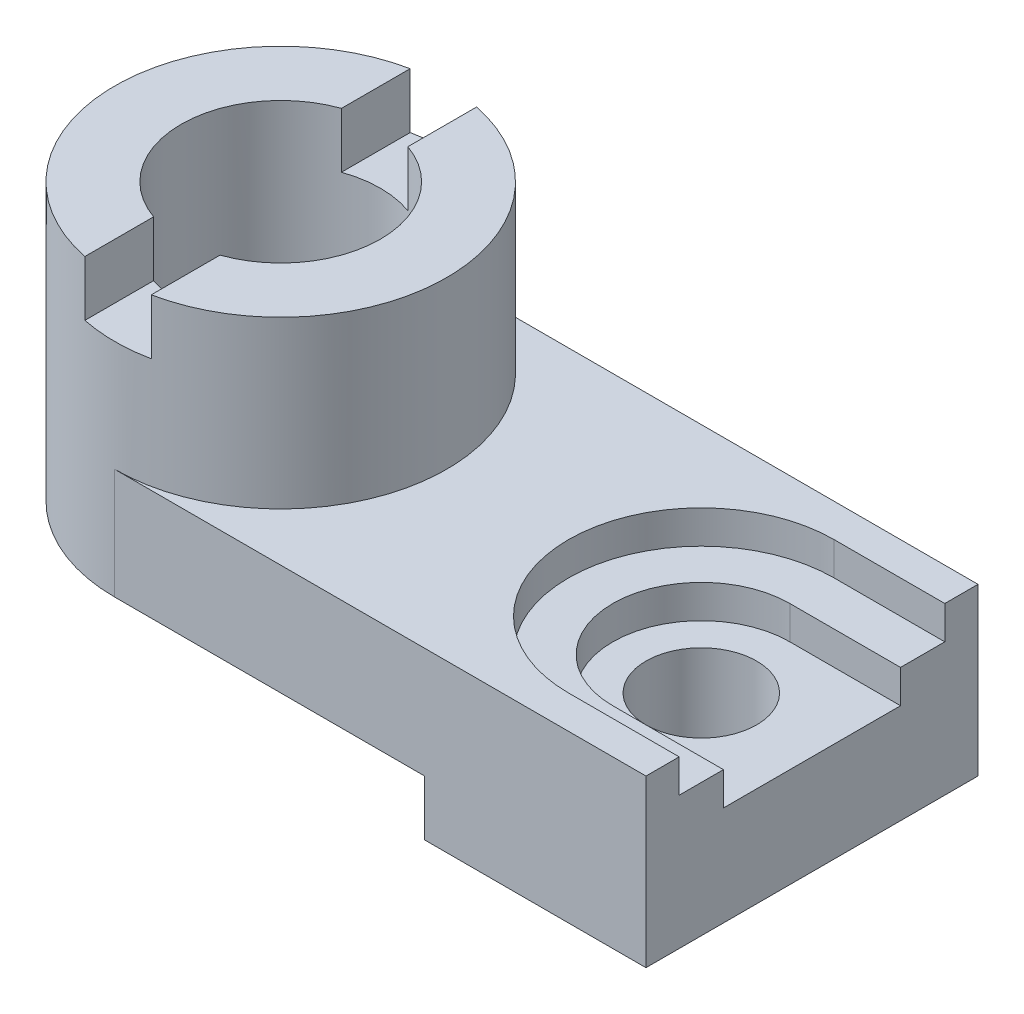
SolidWorks part; units mm, degrees
ref_plane "前视" through (0, 0, 0) normal (0, 0, 1) x (1, 0, 0)
ref_plane "上视" through (0, 0, 0) normal (0, 1, 0) x (1, 0, 0)
ref_plane "右视" through (0, 0, 0) normal (1, 0, 0) x (0, 0, -1)
sketch "草图1" plane through (0, 0, 0) normal (0, 0, 1) x (1, 0, 0)
  line L0 (0, 0) -> (0, 71.7849) construction
  line L1 (-12, 0) -> (-15, 0)
  line L2 (-15, 0) -> (-15, 25)
  line L3 (-15, 25) -> (-9, 25)
  line L4 (-9, 25) -> (-9, 5)
  line L5 (-9, 5) -> (-12, 5)
  line L6 (-12, 5) -> (-12, 0)
  dimension "D1" = 30
  dimension "D2" = 25
  dimension "D3" = 18
  dimension "D4" = 24
  dimension "D5" = 5
revolve "旋转1" add sketch "草图1" angle 360 about L0
sketch "草图2" plane through (0, 0, 0) normal (0, 0, 1) x (1, 0, 0)
  line L0 (0, 0) -> (0, 26.3165) construction
  line L1 (0, 0) -> (0, 71.7849) construction
  line L2 (-3, 25) -> (-3, 20)
  line L3 (15, 25) -> (-15, 25) construction
  line L4 (3, 25) -> (3, 20)
  line L5 (-3, 20) -> (3, 20)
  line L6 (9, 25) -> (-9, 25) construction
  line L7 (3, 25) -> (-3, 25)
  point P12 (0, 20)
  dimension "D1" = 6
  dimension "D2" = 5
extrude "切除-拉伸1" cut sketch "草图2" against normal mid plane 50
sketch "草图4" plane through (0, 0, 0) normal (0, -1, 0) x (1, 0, 0)
  line L0 (0, 0) -> (41.4256, 0) construction
  line L1 (0, -15) -> (48, -15)
  line L2 (0, 15) -> (48, 15)
  line L3 (48, -15) -> (48, 15)
  arc A0 (-3, -14.6969) -> (3, -14.6969) centre (0, 0) ccw construction
  circle A1 centre (0, 0) radius 15 construction
  arc A2 (0, -15) -> (0, 15) centre (0, 0) ccw
  circle A3 centre (38, 0) radius 5
  point P11 (48, 0)
  dimension "D2" = 10
  dimension "D1" = 48
  dimension "D3" = 10
extrude "拉伸1" add sketch "草图4" against normal blind 10
sketch "草图5" plane through (0, 0, 0) normal (0, 1, 0) x (1, 0, 0)
  line L0 (48, 15) -> (48, -15) construction
  line L1 (48, 15) -> (48, -15)
  line L2 (0, 15) -> (48, 15) construction
  line L3 (28, 15) -> (48, 15)
  line L4 (48, -15) -> (0, -15) construction
  line L5 (48, -15) -> (28, -15)
  line L6 (28, 15) -> (28, -15)
  circle A0 centre (38, 0) radius 5 construction
  circle A1 centre (38, 0) radius 5
  dimension "D1" = 20
extrude "拉伸2" add sketch "草图5" against normal blind 5
sketch "草图6" plane through (0, 10, 0) normal (0, 1, 0) x (-1, 0, 0)
  line L0 (-26.9709, 0) -> (-50.1427, 0) construction
  line L1 (-48, -12) -> (-38, -12)
  line L2 (-48, -15) -> (-48, 15) construction
  line L3 (-48, 12) -> (-38, 12)
  line L4 (-48, -12) -> (-48, 12)
  arc A0 (-38, -12) -> (-38, 12) centre (-38, 0) ccw
  circle A1 centre (-38, 0) radius 5 construction
  dimension "D1" = 12
extrude "切除-拉伸2" cut sketch "草图6" against normal blind 3
sketch "草图7" plane through (0, 7, 0) normal (0, 1, 0) x (-1, 0, 0)
  line L0 (-21.8324, 0) -> (-49.9488, 0) construction
  line L1 (-48, -8) -> (-38, -8)
  line L2 (-48, 12) -> (-48, -12) construction
  line L3 (-48, 8) -> (-38, 8)
  line L4 (-48, 8) -> (-48, -8)
  arc A0 (-38, -8) -> (-38, 8) centre (-38, 0) ccw
  circle A1 centre (-38, 0) radius 5 construction
  dimension "D1" = 8
extrude "切除-拉伸3" cut sketch "草图7" against normal blind 3
